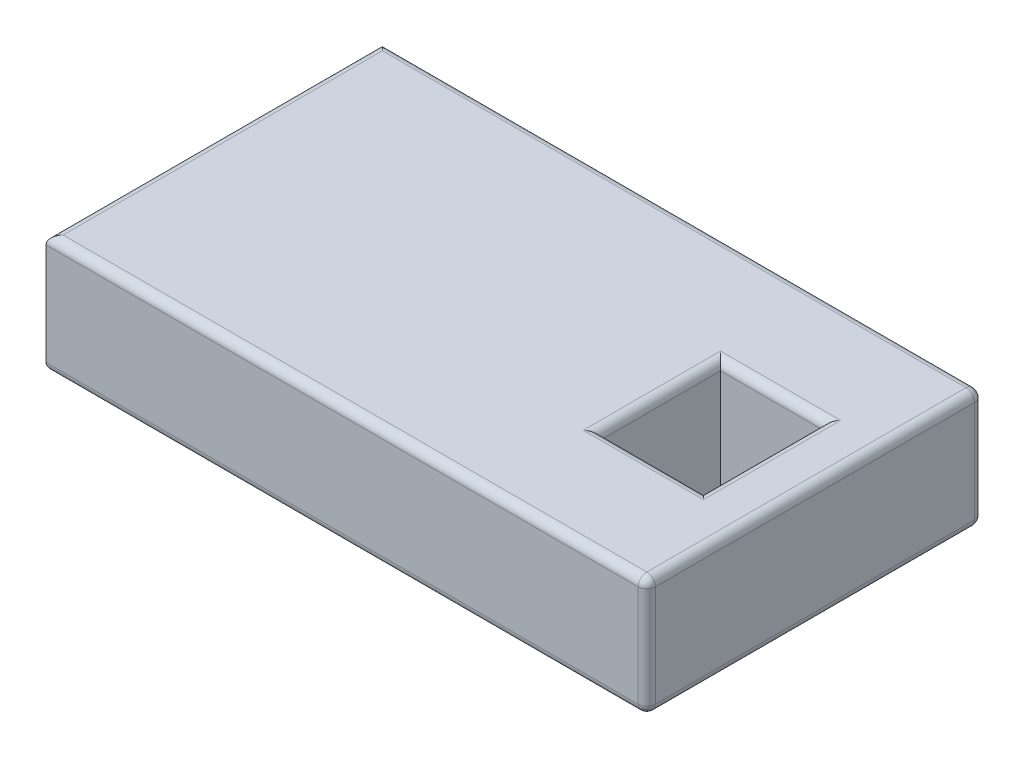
SolidWorks part; units mm, degrees
ref_plane "Front Plane" through (0, 0, 0) normal (0, 0, 1) x (1, 0, 0)
ref_plane "Top Plane" through (0, 0, 0) normal (0, 1, 0) x (1, 0, 0)
ref_plane "Right Plane" through (0, 0, 0) normal (1, 0, 0) x (0, 0, -1)
sketch "Sketch1" plane through (0, 0, 0) normal (1, 0, 0) x (0, 0, -1)
  line L1 (-9.795, 3.46) -> (9.795, 3.46)
  line L2 (-9.795, 3.46) -> (-9.795, -3.46)
  line L3 (-9.795, -3.46) -> (9.795, -3.46)
  line L4 (9.795, 3.46) -> (9.795, -3.46)
  line L5 (-9.795, 3.46) -> (9.795, -3.46) construction
  line L6 (-9.795, -3.46) -> (9.795, 3.46) construction
  point P0 (0, 0)
  dimension "D1" = 6.92
  dimension "D2" = 19.59
extrude "Boss-Extrude1" add sketch "Sketch1" along normal blind 35
sketch "Sketch2" plane through (0, 3.46, 0) normal (0, 1, 0) x (1, 0, 0)
  line L0 (32, -3.5) -> (32, -9.795) construction
  line L1 (26, 3.5) -> (32, 3.5)
  line L2 (26, 3.5) -> (26, -3.5)
  line L3 (26, -3.5) -> (32, -3.5)
  line L4 (32, 3.5) -> (32, -3.5)
  line L5 (35, -9.795) -> (0, -9.795) construction
  line L6 (32, 3.5) -> (32, 9.795) construction
  line L7 (35, 9.795) -> (0, 9.795) construction
  line L8 (35, 9.795) -> (35, -9.795) construction
  dimension "D1" = 6
  dimension "D2" = 7
  dimension "D3" = 3
extrude "Cut-Extrude1" cut sketch "Sketch2" against normal through all
sketch "Sketch3" plane through (0, 0, 0) normal (-1, 0, 0) x (0, 0, 1)
  line L0 (-5.858, 0) -> (-9.795, 0) construction
  line L1 (-9.795, -3.46) -> (-9.795, 3.46) construction
  line L2 (5.858, 0) -> (9.795, 0) construction
  line L3 (9.795, 3.46) -> (9.795, -3.46) construction
  circle A0 centre (-5.858, 0) radius 2.16
  circle A1 centre (5.858, 0) radius 2.16
  dimension "D1" = 4.32
  dimension "D2" = 3.937
extrude "Cut-Extrude2" cut sketch "Sketch3" against normal blind 2
fillet "Fillet1" radius 0.5 18 edges at (17.5, -3.46, 9.795) (17.5, -3.46, -9.795) (0, -3.46, 0) (32, -3.46, 0) (29, -3.46, 3.5) (26, -3.46, 0) (29, -3.46, -3.5) (35, -3.46, 0) (35, 0, 9.795) (35, 0, -9.795) (17.5, 3.46, -9.795) (35, 3.46, 0) (17.5, 3.46, 9.795) (0, 3.46, 0) (32, 3.46, 0) (29, 3.46, -3.5) (26, 3.46, 0) (29, 3.46, 3.5)
